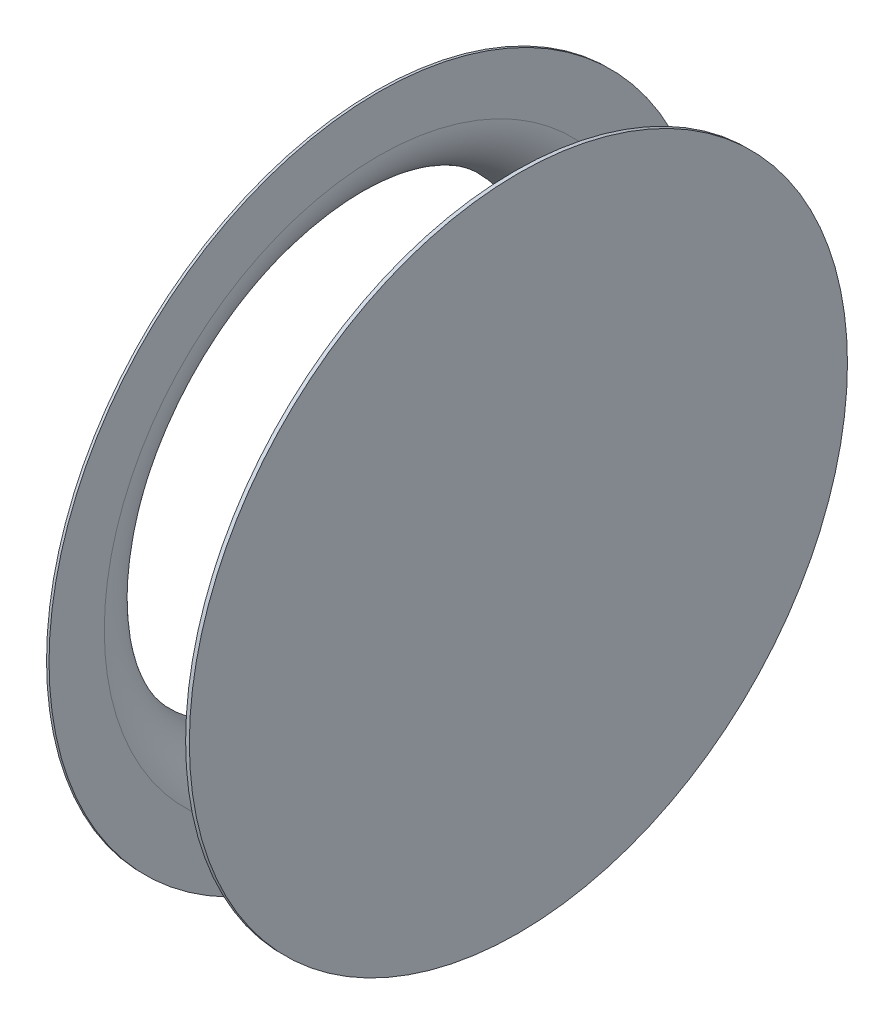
SolidWorks part; units mm, degrees
ref_plane "Vorne" through (0, 0, 0) normal (0, 0, 1) x (1, 0, 0)
ref_plane "Drauf" through (0, 0, 0) normal (0, 1, 0) x (1, 0, 0)
ref_plane "Seite" through (0, 0, 0) normal (1, 0, 0) x (0, 0, -1)
sketch "Skizze3" plane through (0, 0, 0) normal (1, 0, 0) x (0, -1, 0)
  circle A0 centre (0, 0) radius 530
  dimension "D1" = 1060
extrude "Linear austragen1" add sketch "Skizze3" along normal blind 6
sketch "Skizze4" plane through (0, 0, 0) normal (0, 1, 0) x (1, 0, 0)
  line L0 (-224, 530) -> (-224, 441)
  line L1 (6, -530) -> (6, 530) construction
  line L2 (6, 530) -> (0, 530) construction
  line L3 (-337.7638, 0) -> (114.3554, 0) construction
  line L5 (-220, 530) -> (-220, 441)
  line L6 (-224, 530) -> (-220, 530)
  line L7 (-309, 356) -> (-309, 352)
  arc A0 (-224, 441) -> (-309, 356) centre (-309, 441) cw
  arc A1 (-220, 441) -> (-309, 352) centre (-309, 441) cw
  dimension "D1" = 85
  dimension "D3" = 315
  dimension "D2" = 712
  dimension "D4" = 4
revolve "Rotation1" add sketch "Skizze4" angle 360 about L3
sketch "Skizze5" plane through (0, 0, 0) normal (-1, 0, 0) x (0, 0, 1)
  arc A0 (0, 530) -> (-211.5952, 286.2926) centre (482.7829, -102.8797) ccw
  circle A1 centre (0, 0) radius 530 construction
  circle A2 centre (0, 0) radius 356 construction
  dimension "D1" = 796
  dimension "D2" = 325
